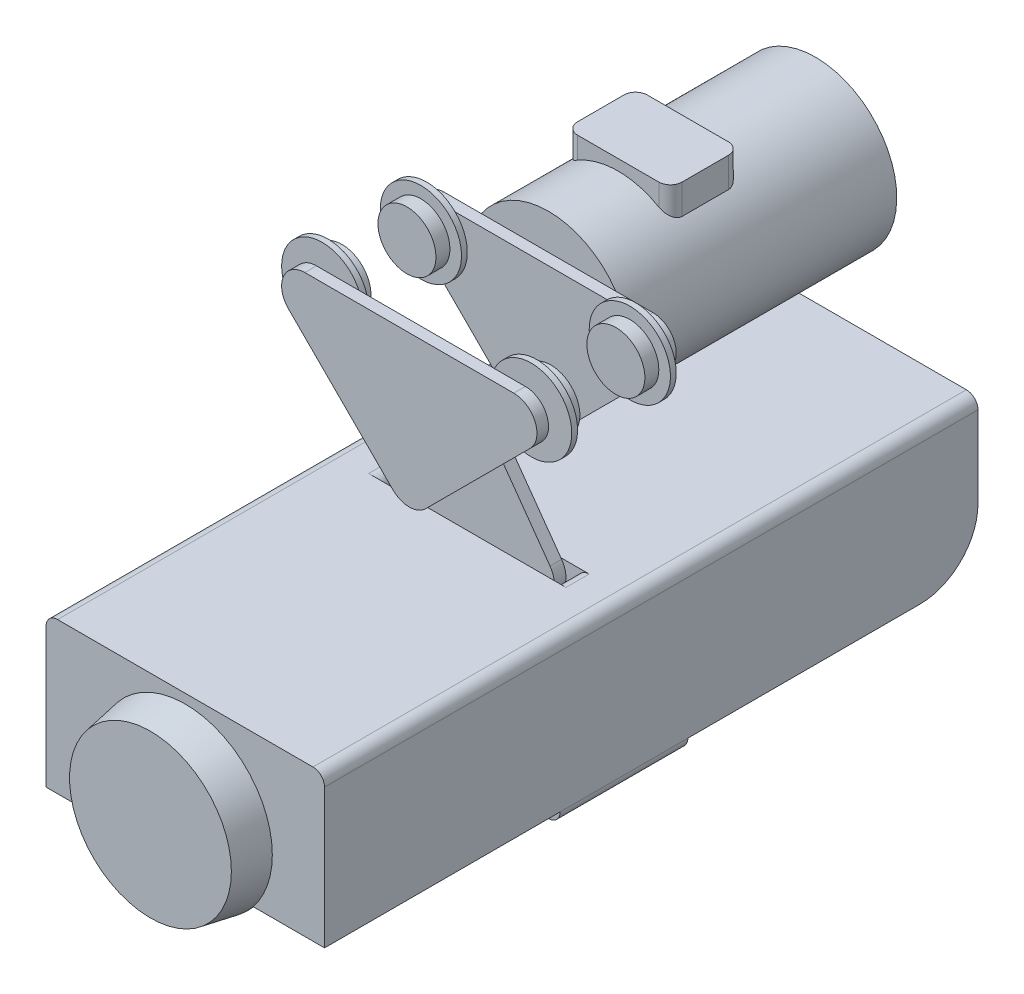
SolidWorks part; units mm, degrees
ref_plane "Plan de face" through (0, 0, 0) normal (0, 0, 1) x (1, 0, 0)
ref_plane "Plan de dessus" through (0, 0, 0) normal (0, 1, 0) x (1, 0, 0)
ref_plane "Plan de droite" through (0, 0, 0) normal (1, 0, 0) x (0, 0, -1)
sketch "Esquisse1" plane through (0, 0, 0) normal (0, 0, 1) x (1, 0, 0)
  line L0 (-90, 0) -> (90, 0)
  line L1 (104.1421, -34.1421) -> (14.1421, -124.1421)
  line L2 (-14.1421, -124.1421) -> (-104.1421, -34.1421)
  arc A0 (14.1421, -124.1421) -> (-14.1421, -124.1421) centre (0, -110) cw
  arc A1 (90, 0) -> (104.1421, -34.1421) centre (90, -20) cw
  arc A2 (-104.1421, -34.1421) -> (-90, 0) centre (-90, -20) cw
  point P6 (0, -138.2843)
  dimension "D1" = 20
  dimension "D2" = 180
extrude "Boss.-Extru.1" add sketch "Esquisse1" along normal blind 10
sketch "Esquisse3" plane through (0, 0, 0) normal (0, 0, -1) x (-1, 0, 0)
  circle A0 centre (-90, -20) radius 10
  circle A1 centre (90, -20) radius 10
  arc A2 (-90, 0) -> (-104.1421, -34.1421) centre (-90, -20) ccw construction
  arc A3 (104.1421, -34.1421) -> (90, 0) centre (90, -20) ccw construction
  dimension "D1" = 20
extrude "Boss.-Extru.2" add sketch "Esquisse3" along normal blind 5
sketch "Esquisse4" plane through (0, 0, -5) normal (0, 0, -1) x (-1, 0, 0)
  circle A0 centre (-90, -20) radius 35
  circle A1 centre (90, -20) radius 35
  dimension "D1" = 70
extrude "Boss.-Extru.3" add sketch "Esquisse4" along normal blind 5
sketch "Esquisse5" plane through (0, 0, -10) normal (0, 0, -1) x (-1, 0, 0)
  circle A0 centre (-90, -20) radius 25
  circle A1 centre (90, -20) radius 25
  dimension "D1" = 50
extrude "Boss.-Extru.4" add sketch "Esquisse5" along normal blind 12
sketch "Esquisse6" plane through (0, 0, 0) normal (0, 0, -1) x (-1, 0, 0)
  circle A0 centre (0, -110) radius 15
  arc A1 (-14.1421, -124.1421) -> (14.1421, -124.1421) centre (0, -110) ccw construction
  dimension "D1" = 30
extrude "Boss.-Extru.5" add sketch "Esquisse6" along normal blind 100
ref_plane "Plan1" through (0, 0, -50) normal (0, 0, -1) x (-1, 0, 0)
mirror "Symétrie3" about plane through (0, 0, -50) normal (0, 0, -1) of "Boss.-Extru.4", "Boss.-Extru.2", "Boss.-Extru.3", "Boss.-Extru.1"
sketch "Esquisse7" plane through (0, 0, -110) normal (0, 0, -1) x (-1, 0, 0)
  line L0 (-14.1421, -124.1421) -> (-104.1421, -34.1421) construction
  line L1 (104.1421, -34.1421) -> (14.1421, -124.1421) construction
  circle A0 centre (0, -39.2893) radius 70
  dimension "D1" = 140
extrude "Boss.-Extru.6" add sketch "Esquisse7" along normal blind 230
sketch "Esquisse8" plane through (0, 0, -50) normal (0, 0, -1) x (-1, 0, 0)
  line L0 (0, -110) -> (0, -180) construction
  line L1 (-50, -180) -> (50, -180) construction
  line L2 (-16.2747, -98.3752) -> (-66.2747, -168.3752)
  line L3 (-50, -200) -> (50, -200)
  line L4 (16.2747, -98.3752) -> (66.2747, -168.3752)
  arc A0 (-66.2747, -168.3752) -> (-50, -200) centre (-50, -180) ccw
  arc A1 (50, -200) -> (66.2747, -168.3752) centre (50, -180) ccw
  arc A2 (16.2747, -98.3752) -> (-16.2747, -98.3752) centre (0, -110) ccw
  dimension "D1" = 70
  dimension "D3" = 20
  dimension "D2" = 100
extrude "Boss.-Extru.7" add sketch "Esquisse8" along normal mid plane 10
sketch "Esquisse9" plane through (0, 0, -50) normal (0, 0, -1) x (-1, 0, 0)
  line L0 (0, 0) -> (0, -197.0249) construction
  line L1 (-120, -172.4608) -> (-75, -172.4608)
  line L2 (-120, -172.4608) -> (-120, -312.4608)
  line L3 (-120, -312.4608) -> (120, -312.4608)
  line L4 (120, -172.4608) -> (120, -312.4608)
  line L5 (-75, -172.4608) -> (-75, -197.0249)
  line L6 (-75, -197.0249) -> (75, -197.0249)
  line L7 (75, -197.0249) -> (75, -172.4608)
  line L8 (75, -172.4608) -> (120, -172.4608)
  dimension "D1" = 240
  dimension "D2" = 45
  dimension "D3" = 140
extrude "Boss.-Extru.8" add sketch "Esquisse9" along normal mid plane 20
fillet "Congé1" radius 10 8 edges at (-120, -312.4608, -50) (-120, -172.4608, -50) (-75, -197.0249, -50) (75, -197.0249, -50) (-75, -172.4608, -50) (75, -172.4608, -50) (120, -172.4608, -50) (120, -312.4608, -50)
sketch "Esquisse10" plane through (0, 0, -60) normal (0, 0, -1) x (-1, 0, 0)
  line L0 (-120, -182.4608) -> (-120, -302.4608) construction
  line L1 (-110, -312.4608) -> (110, -312.4608) construction
  line L2 (120, -302.4608) -> (120, -182.4608) construction
  line L3 (-120, -182.4608) -> (-120, -302.4608)
  line L4 (-110, -312.4608) -> (110, -312.4608)
  line L5 (120, -302.4608) -> (120, -182.4608)
  line L6 (-110, -172.4608) -> (110, -172.4608)
  arc A0 (-120, -302.4608) -> (-110, -312.4608) centre (-110, -302.4608) ccw construction
  arc A1 (110, -312.4608) -> (120, -302.4608) centre (110, -302.4608) ccw construction
  arc A2 (120, -182.4608) -> (110, -172.4608) centre (110, -182.4608) ccw construction
  arc A3 (-110, -172.4608) -> (-120, -182.4608) centre (-110, -182.4608) ccw construction
  arc A4 (-120, -302.4608) -> (-110, -312.4608) centre (-110, -302.4608) ccw
  arc A5 (110, -312.4608) -> (120, -302.4608) centre (110, -302.4608) ccw
  arc A6 (120, -182.4608) -> (110, -172.4608) centre (110, -182.4608) ccw
  arc A7 (-110, -172.4608) -> (-120, -182.4608) centre (-110, -182.4608) ccw
extrude "Boss.-Extru.9" add sketch "Esquisse10" along normal blind 50
sketch "Esquisse11" plane through (0, 0, -110) normal (0, 0, -1) x (-1, 0, 0)
  line L0 (-120, -182.4608) -> (-120, -302.4608) construction
  line L1 (110, -172.4608) -> (-110, -172.4608) construction
  line L2 (120, -302.4608) -> (120, -182.4608) construction
  line L3 (-120, -182.4608) -> (-120, -302.4608)
  line L4 (110, -172.4608) -> (-110, -172.4608)
  line L5 (120, -302.4608) -> (120, -182.4608)
  line L6 (117, -302.4608) -> (117, -182.4608)
  line L7 (110, -175.4608) -> (-110, -175.4608)
  line L8 (-117, -182.4608) -> (-117, -302.4608)
  line L9 (-120, -302.4608) -> (-117, -302.4608)
  line L10 (117, -302.4608) -> (120, -302.4608)
  arc A0 (-110, -172.4608) -> (-120, -182.4608) centre (-110, -182.4608) ccw construction
  arc A1 (120, -182.4608) -> (110, -172.4608) centre (110, -182.4608) ccw construction
  arc A2 (-110, -172.4608) -> (-120, -182.4608) centre (-110, -182.4608) ccw
  arc A3 (120, -182.4608) -> (110, -172.4608) centre (110, -182.4608) ccw
  arc A4 (117, -182.4608) -> (110, -175.4608) centre (110, -182.4608) ccw
  arc A5 (-110, -175.4608) -> (-117, -182.4608) centre (-110, -182.4608) ccw
  dimension "D1" = 3
extrude "Boss.-Extru.10" add sketch "Esquisse11" along normal blind 250
fillet "Congé2" radius 50 2 edges at (-118.5, -302.4608, -360) (118.5, -302.4608, -360)
sketch "Esquisse12" plane through (0, 0, -110) normal (0, 0, -1) x (-1, 0, 0)
  line L1 (-110, -175.4608) -> (110, -175.4608) construction
  circle A0 centre (0, -255.4608) radius 75
  dimension "D1" = 150
  dimension "D2" = 80
extrude "Boss.-Extru.12" add sketch "Esquisse12" along normal blind 250
sketch "Esquisse13" plane through (0, -312.4608, 0) normal (0, -1, 0) x (1, 0, 0)
  line L0 (0, 0) -> (0, -170) construction
  line L1 (-45, -170) -> (45, -170)
  line L2 (-45, -170) -> (-45, -230)
  line L3 (-45, -230) -> (45, -230)
  line L4 (45, -170) -> (45, -230)
  line L5 (48.7442, -110) -> (-48.7442, -110) construction
  dimension "D1" = 60
  dimension "D2" = 90
  dimension "D3" = 60
extrude "Boss.-Extru.13" add sketch "Esquisse13" along normal blind 30
fillet "Congé3" radius 10 4 edges at (45, -328.9608, -170) (45, -328.9608, -230) (-45, -328.9608, -230) (-45, -328.9608, -170)
sketch "Esquisse14" plane through (0, 0, 0) normal (0, 1, 0) x (1, 0, 0)
  line L0 (0, 0) -> (0, 170) construction
  line L1 (-35, 230) -> (35, 230)
  line L2 (-45, 220) -> (-45, 180)
  line L3 (-35, 170) -> (35, 170)
  line L4 (45, 220) -> (45, 180)
  line L5 (57.934, 110) -> (-57.934, 110) construction
  arc A0 (35, 230) -> (45, 220) centre (35, 220) cw
  arc A1 (45, 180) -> (35, 170) centre (35, 180) cw
  arc A2 (-35, 170) -> (-45, 180) centre (-35, 180) cw
  arc A3 (-45, 220) -> (-35, 230) centre (-35, 220) cw
  point P11 (45, 230)
  point P14 (45, 170)
  point P19 (-45, 230)
  dimension "D4" = 10
  dimension "D1" = 90
  dimension "D2" = 60
  dimension "D3" = 60
extrude "Boss.-Extru.14" add sketch "Esquisse14" along normal blind 40
sketch "Esquisse15" plane through (0, 0, -40) normal (0, 0, 1) x (1, 0, 0)
  line L0 (-120, -302.4608) -> (-120, -182.4608) construction
  line L1 (110, -312.4608) -> (-110, -312.4608) construction
  line L2 (120, -182.4608) -> (120, -302.4608) construction
  line L4 (-120, -302.4608) -> (-120, -182.4608)
  line L5 (110, -312.4608) -> (-110, -312.4608)
  line L6 (120, -182.4608) -> (120, -302.4608)
  line L8 (-110, -172.4608) -> (110, -172.4608)
  arc A0 (-110, -172.4608) -> (-120, -182.4608) centre (-110, -182.4608) ccw construction
  arc A1 (-120, -302.4608) -> (-110, -312.4608) centre (-110, -302.4608) ccw construction
  arc A2 (110, -312.4608) -> (120, -302.4608) centre (110, -302.4608) ccw construction
  arc A3 (120, -182.4608) -> (110, -172.4608) centre (110, -182.4608) ccw construction
  arc A4 (-110, -172.4608) -> (-120, -182.4608) centre (-110, -182.4608) ccw
  arc A5 (-120, -302.4608) -> (-110, -312.4608) centre (-110, -302.4608) ccw
  arc A6 (110, -312.4608) -> (120, -302.4608) centre (110, -302.4608) ccw
  arc A7 (120, -182.4608) -> (110, -172.4608) centre (110, -182.4608) ccw
extrude "Boss.-Extru.15" add sketch "Esquisse15" along normal blind 40
sketch "Esquisse16" plane through (0, 0, 0) normal (0, 0, 1) x (1, 0, 0)
  line L0 (-120, -182.4608) -> (-120, -302.4608) construction
  line L1 (110, -172.4608) -> (-110, -172.4608) construction
  line L2 (120, -302.4608) -> (120, -182.4608) construction
  line L3 (-120, -182.4608) -> (-120, -302.4608)
  line L4 (110, -172.4608) -> (-110, -172.4608)
  line L5 (120, -302.4608) -> (120, -182.4608)
  line L6 (117, -302.4608) -> (117, -182.4608)
  line L7 (110, -175.4608) -> (-110, -175.4608)
  line L8 (-117, -182.4608) -> (-117, -302.4608)
  line L9 (-120, -302.4608) -> (-117, -302.4608)
  line L10 (117, -302.4608) -> (120, -302.4608)
  arc A0 (-110, -172.4608) -> (-120, -182.4608) centre (-110, -182.4608) ccw construction
  arc A1 (120, -182.4608) -> (110, -172.4608) centre (110, -182.4608) ccw construction
  arc A2 (-110, -172.4608) -> (-120, -182.4608) centre (-110, -182.4608) ccw
  arc A3 (120, -182.4608) -> (110, -172.4608) centre (110, -182.4608) ccw
  arc A4 (117, -182.4608) -> (110, -175.4608) centre (110, -182.4608) ccw
  arc A5 (-110, -175.4608) -> (-117, -182.4608) centre (-110, -182.4608) ccw
  dimension "D1" = 3
extrude "Boss.-Extru.16" add sketch "Esquisse16" along normal blind 200
sketch "Esquisse17" plane through (0, 0, 200) normal (0, 0, 1) x (1, 0, 0)
  line L0 (-120, -182.4608) -> (-120, -302.4608) construction
  line L1 (110, -172.4608) -> (-110, -172.4608) construction
  line L2 (120, -302.4608) -> (120, -182.4608) construction
  line L3 (-120, -182.4608) -> (-120, -302.4608)
  line L4 (110, -172.4608) -> (-110, -172.4608)
  line L5 (120, -302.4608) -> (120, -182.4608)
  line L6 (-120, -302.4608) -> (-58.4466, -302.4608)
  line L7 (58.4466, -302.4608) -> (120, -302.4608)
  arc A0 (-110, -172.4608) -> (-120, -182.4608) centre (-110, -182.4608) ccw construction
  arc A1 (120, -182.4608) -> (110, -172.4608) centre (110, -182.4608) ccw construction
  arc A2 (-110, -172.4608) -> (-120, -182.4608) centre (-110, -182.4608) ccw
  arc A3 (120, -182.4608) -> (110, -172.4608) centre (110, -182.4608) ccw
  circle A4 centre (0, -255.4608) radius 75 construction
  arc A5 (-58.4466, -302.4608) -> (58.4466, -302.4608) centre (0, -255.4608) ccw
extrude "Boss.-Extru.17" add sketch "Esquisse17" along normal blind 3
sketch "Esquisse18" plane through (0, 0, 200) normal (0, 0, -1) x (-1, 0, 0)
  circle A0 centre (0, -255.4608) radius 50
  arc A1 (-58.4466, -302.4608) -> (58.4466, -302.4608) centre (0, -255.4608) ccw construction
  dimension "D1" = 100
extrude "Boss.-Extru.18" add sketch "Esquisse18" along normal up to next
sketch "Esquisse19" plane through (0, 0, 203) normal (0, 0, 1) x (1, 0, 0)
  circle A0 centre (0, -255.4608) radius 75
  arc A1 (-58.4466, -302.4608) -> (58.4466, -302.4608) centre (0, -255.4608) ccw construction
extrude "Boss.-Extru.19" add sketch "Esquisse19" along normal blind 30 draft 10
